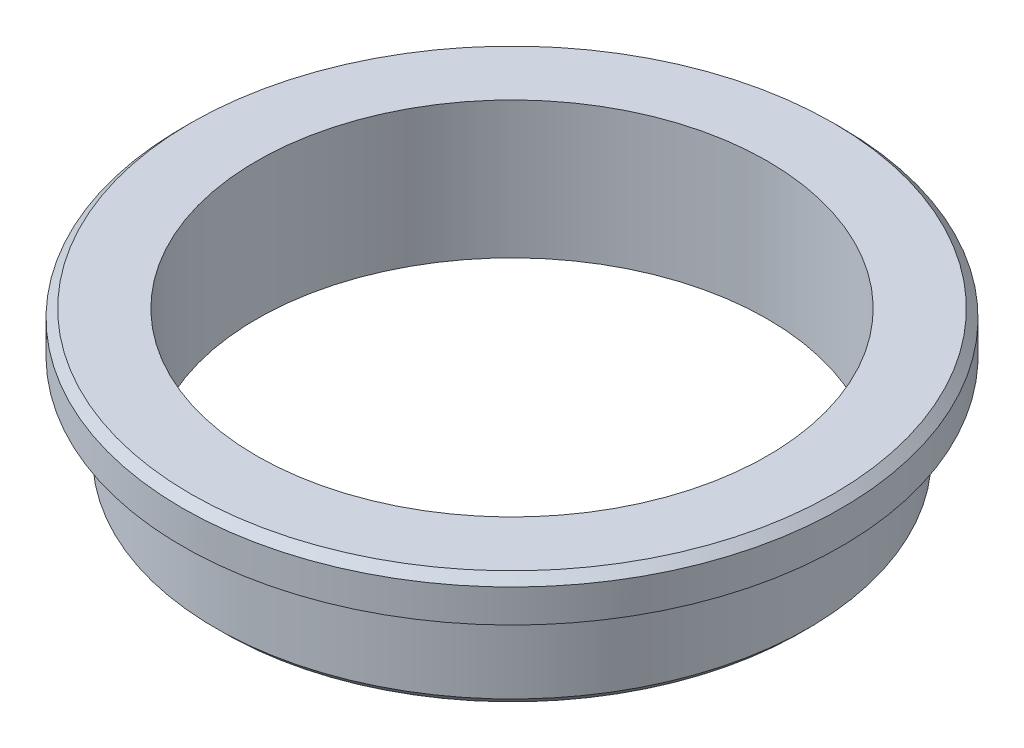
SolidWorks part; units mm, degrees
ref_plane "Face" through (0, 0, 0) normal (0, 0, 1) x (1, 0, 0)
ref_plane "Dessus" through (0, 0, 0) normal (0, 1, 0) x (1, 0, 0)
ref_plane "Droite" through (0, 0, 0) normal (1, 0, 0) x (0, 0, -1)
sketch "Esquisse1" plane through (0, 0, 0) normal (0, 0, 1) x (1, 0, 0)
  line L0 (0, 0) -> (0, 26.9179) construction
  line L1 (15.5, 2.5) -> (20, 2.5)
  line L2 (20, 2.5) -> (20, 0)
  line L3 (20, 0) -> (18, 0)
  line L4 (18, 0) -> (18, -5.8)
  line L5 (18, -5.8) -> (15.5, -5.8)
  line L6 (15.5, -5.8) -> (15.5, 2.5)
  dimension "D1" = 2.5
  dimension "D2" = 5.8
  dimension "D3" = 40
  dimension "D4" = 31
  dimension "D5" = 36
revolve "Révolution1" add sketch "Esquisse1" angle 360 about L0
chamfer "Chanfrein1" distance 0.5 angle 45 2 edges at (0, -5.8, -18) (0, 2.5, -20)
